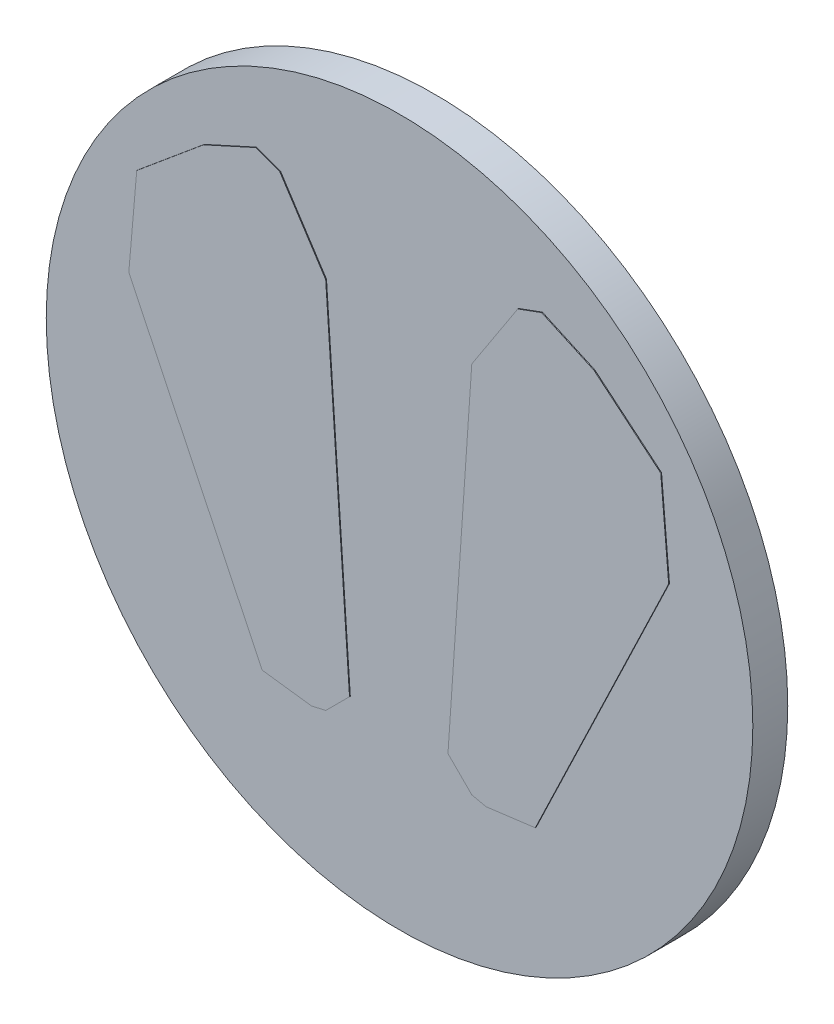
SolidWorks part; units mm, degrees
ref_plane "Plan de face" through (0, 0, 0) normal (0, 0, 1) x (1, 0, 0)
ref_plane "Plan de dessus" through (0, 0, 0) normal (0, 1, 0) x (1, 0, 0)
ref_plane "Plan de droite" through (0, 0, 0) normal (1, 0, 0) x (0, 0, -1)
sketch "Esquisse1" plane through (0, 0, 0) normal (0, 0, 1) x (1, 0, 0)
  circle A0 centre (0, 0) radius 222.5
  dimension "D1" = 445
extrude "Extrusion1" add sketch "Esquisse1" along normal blind 22
sketch "Esquisse2" plane through (0, 0, 22) normal (0, 0, 1) x (1, 0, 0)
  line L0 (0, 222.5) -> (0, -222.5)
  line L1 (31, -110.5) -> (46, 109.5)
  line L2 (0, 0) -> (222.5, 0) construction
  line L3 (86, -123.5) -> (170, 51.5)
  line L4 (170, 51.5) -> (165, 109.5)
  line L5 (165, 109.5) -> (123, 144.5)
  line L6 (123, 144.5) -> (90, 159.5)
  line L7 (86, -123.5) -> (55, -127.5)
  line L8 (55, -127.5) -> (46, -125.5)
  line L9 (46, -125.5) -> (31, -110.5)
  line L10 (90, 159.5) -> (75, 154)
  line L11 (75, 154) -> (46, 109.5)
  line L12 (-55, -127.5) -> (-46, -125.5)
  line L13 (-46, -125.5) -> (-31, -110.5)
  line L14 (-86, -123.5) -> (-55, -127.5)
  line L15 (-86, -123.5) -> (-170, 51.5)
  line L16 (-170, 51.5) -> (-165, 109.5)
  line L17 (-165, 109.5) -> (-123, 144.5)
  line L18 (-123, 144.5) -> (-90, 159.5)
  line L19 (-90, 159.5) -> (-75, 154)
  line L20 (-75, 154) -> (-46, 109.5)
  line L21 (-31, -110.5) -> (-46, 109.5)
  circle A0 centre (0, 0) radius 222.5 construction
  dimension "D1" = 31
  dimension "D2" = 46
  dimension "D3" = 109.5
  dimension "D4" = 110.5
  dimension "D5" = 46
  dimension "D6" = 125.5
  dimension "D7" = 55
  dimension "D8" = 127.5
  dimension "D9" = 86
  dimension "D10" = 123.5
  dimension "D11" = 170
  dimension "D12" = 51.5
  dimension "D13" = 165
  dimension "D14" = 109.5
  dimension "D15" = 123
  dimension "D16" = 144.5
  dimension "D17" = 90
  dimension "D18" = 159.5
  dimension "D19" = 75
  dimension "D20" = 154
extrude "Extrusion4" add sketch "Esquisse2" along normal blind 0.5
